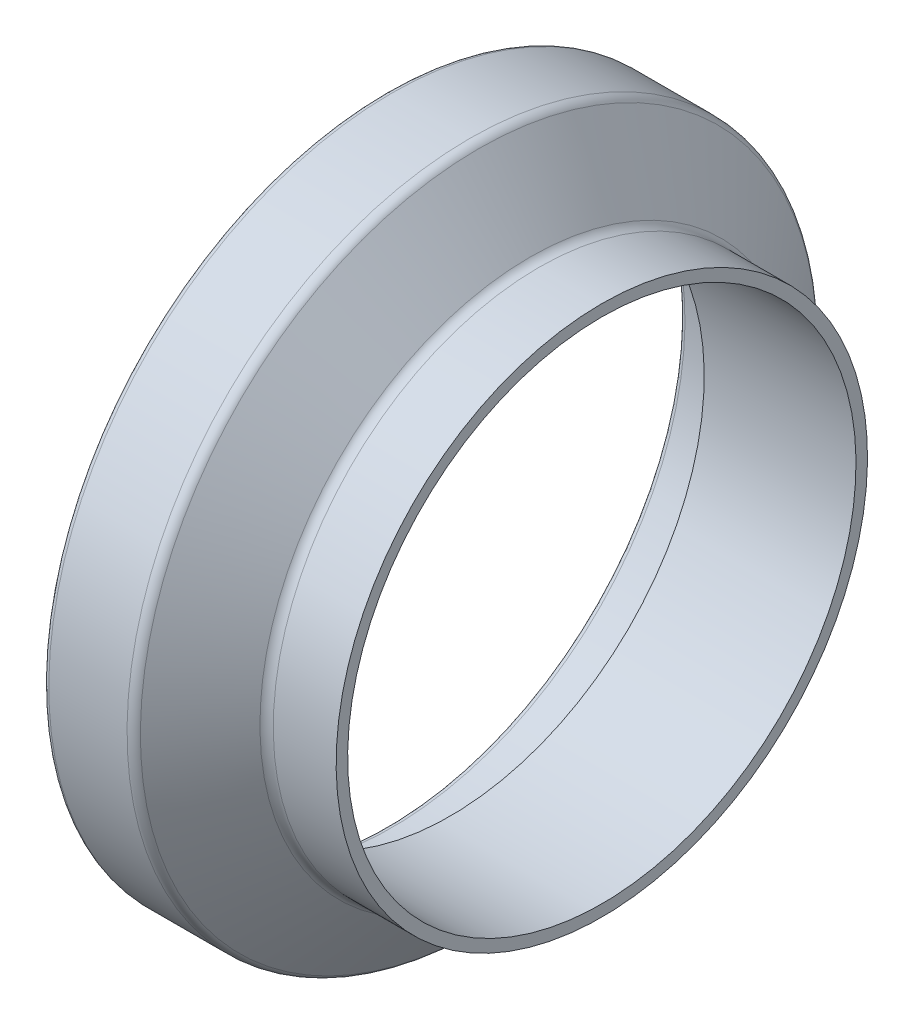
SolidWorks part; units mm, degrees
ref_plane "Front Plane" through (0, 0, 0) normal (0, 0, 1) x (1, 0, 0)
ref_plane "Top Plane" through (0, 0, 0) normal (0, 1, 0) x (1, 0, 0)
ref_plane "Right Plane" through (0, 0, 0) normal (1, 0, 0) x (0, 0, -1)
sketch "Sketch1" plane through (0, 0, 0) normal (0, 0, 1) x (1, 0, 0)
  line L0 (0, 0) -> (-52.2554, 0) construction
  line L1 (-4.827, 36.449) -> (-26.5948, 36.449)
  line L2 (-26.5948, 36.449) -> (-26.5948, 41.2623)
  line L3 (-27.4076, 42.0751) -> (-34.9768, 42.0751)
  line L4 (-35.7896, 42.8879) -> (-35.7896, 48.3362)
  line L5 (-34.9768, 49.149) -> (-23.7604, 49.149)
  line L6 (-22.4824, 48.5118) -> (-15.1167, 38.7372)
  line L7 (-13.8387, 38.1) -> (-4.827, 38.1)
  line L8 (-4.827, 38.1) -> (-4.827, 36.449)
  arc A0 (-34.9768, 49.149) -> (-35.7896, 48.3362) centre (-34.9768, 48.3362) ccw
  arc A1 (-35.7896, 42.8879) -> (-34.9768, 42.0751) centre (-34.9768, 42.8879) ccw
  arc A2 (-27.4076, 42.0751) -> (-26.5948, 41.2623) centre (-27.4076, 41.2623) cw
  arc A3 (-13.8387, 38.1) -> (-15.1167, 38.7372) centre (-13.8387, 39.7002) cw
  arc A4 (-22.4824, 48.5118) -> (-23.7604, 49.149) centre (-23.7604, 47.5488) ccw
  point P13 (-35.7896, 49.149)
  point P16 (-35.7896, 42.0751)
  point P23 (-22.9626, 49.149)
  dimension "D9" = 0.8128
  dimension "D10" = 1.6002
  dimension "D1" = 49.149
  dimension "D2" = 37
  dimension "D3" = 42.0751
  dimension "D4" = 36.449
  dimension "D5" = 12.827
  dimension "D6" = 9.1948
  dimension "D7" = 30.9626
  dimension "D8" = 38.1
revolve "Revolve1" add sketch "Sketch1" angle 360 about L0
